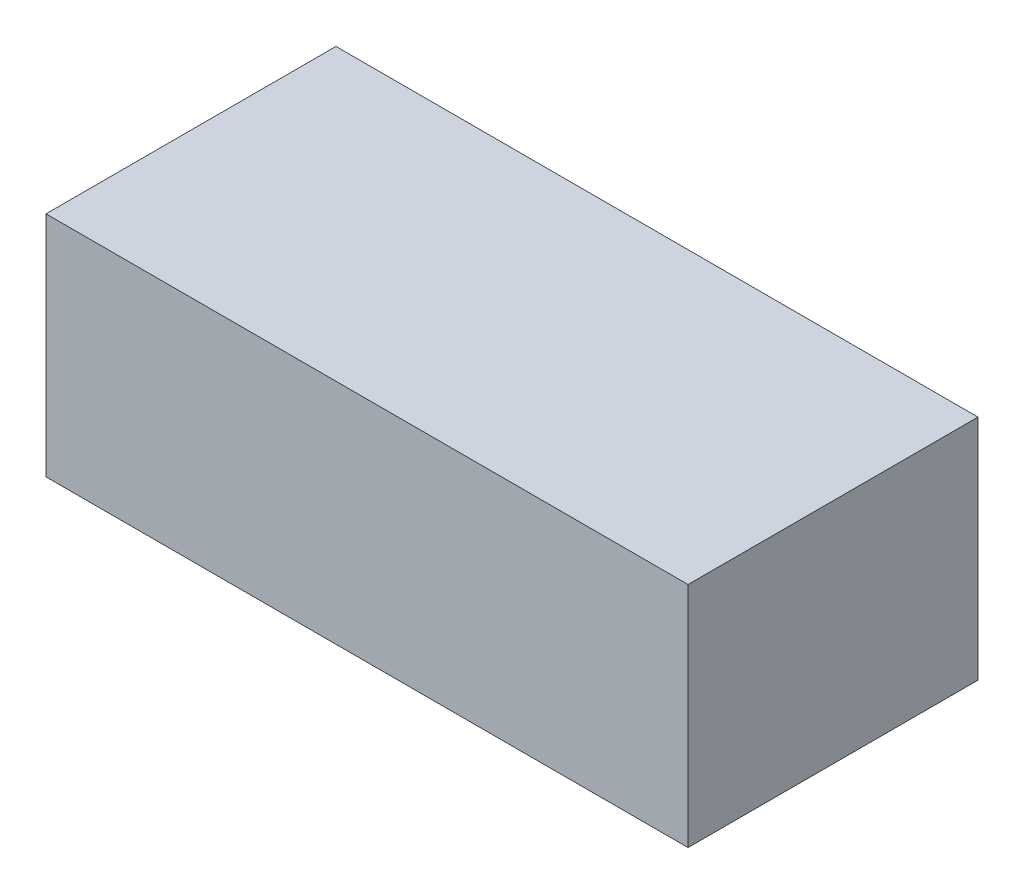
SolidWorks part; units mm, degrees
ref_plane "Front Plane" through (0, 0, 0) normal (0, 0, 1) x (1, 0, 0)
ref_plane "Top Plane" through (0, 0, 0) normal (0, 1, 0) x (1, 0, 0)
ref_plane "Right Plane" through (0, 0, 0) normal (1, 0, 0) x (0, 0, -1)
sketch "Sketch1" plane through (0, 0, 0) normal (0, 1, 0) x (1, 0, 0)
  line L1 (-15.5, 7) -> (15.5, 7)
  line L2 (-15.5, 7) -> (-15.5, -7)
  line L3 (-15.5, -7) -> (15.5, -7)
  line L4 (15.5, 7) -> (15.5, -7)
  line L5 (-15.5, 7) -> (15.5, -7) construction
  line L6 (-15.5, -7) -> (15.5, 7) construction
  point P0 (0, 0)
  dimension "D1" = 14
  dimension "D2" = 31
extrude "Boss-Extrude1" add sketch "Sketch1" along normal blind 11
